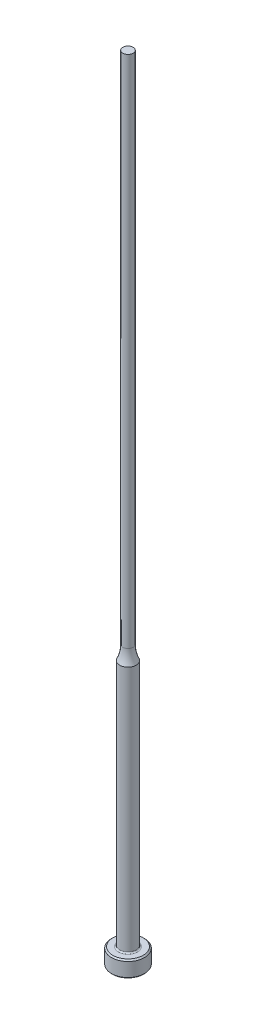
SolidWorks part; units mm, degrees
ref_plane "Front Plane" through (0, 0, 0) normal (0, 0, 1) x (1, 0, 0)
ref_plane "Top Plane" through (0, 0, 0) normal (0, 1, 0) x (1, 0, 0)
ref_plane "Right Plane" through (0, 0, 0) normal (1, 0, 0) x (0, 0, -1)
sketch "Sketch1" plane through (0, 0, 0) normal (0, 0, 1) x (1, 0, 0)
  line L0 (0, 259.9588) -> (0, -15.1925) construction
  line L1 (0, 0) -> (-3.175, 0)
  line L2 (-3.175, 0) -> (-3.175, 3.175)
  line L3 (-3.175, 3.175) -> (-1.5875, 3.175)
  line L4 (-0.9919, 53.4851) -> (-0.9919, 152.4)
  line L5 (-0.9919, 152.4) -> (0, 152.4)
  line L6 (0, 152.4) -> (0, 0)
  line L7 (-1.5875, 3.175) -> (-1.5875, 50.8)
  arc A0 (-1.5875, 50.8) -> (-0.9919, 53.4851) centre (-7.3419, 53.4851) ccw
  point P13 (-1.5875, 0)
  dimension "D1" = 6.35
  dimension "L" = 152.4
  dimension "D2" = 3.175
  dimension "H" = 6.35
  dimension "T" = 3.175
  dimension "D" = 1.9837
  dimension "S" = 50.8
revolve "Revolve1" add sketch "Sketch1" angle 360 about L0
chamfer "Chamfer1" distance 0.254 angle 45 2 edges at (0, 3.175, 3.175) (0, 0, 3.175)
fillet "Fillet1" radius 0.254 1 edges at (0, 3.175, 1.5875)
